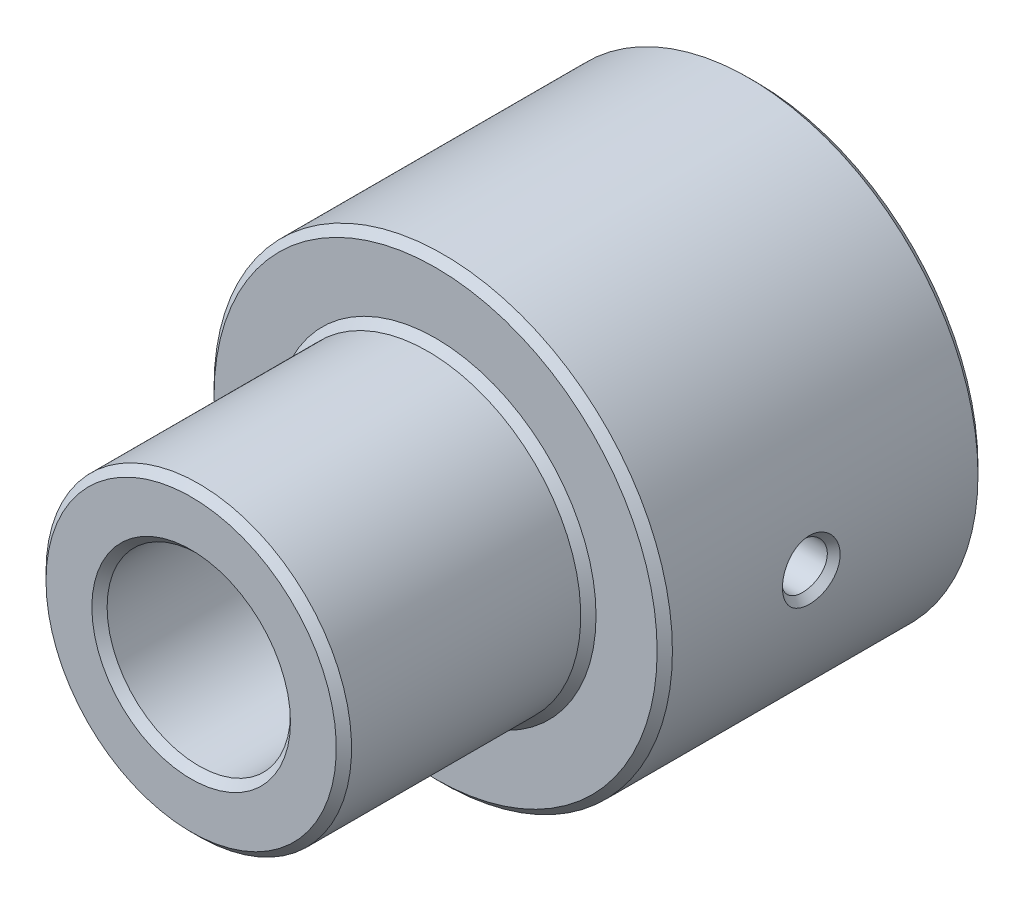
SolidWorks part; units mm, degrees
ref_plane "Спереди" through (0, 0, 0) normal (0, 0, 1) x (1, 0, 0)
ref_plane "Сверху" through (0, 0, 0) normal (0, 1, 0) x (1, 0, 0)
ref_plane "Справа" through (0, 0, 0) normal (1, 0, 0) x (0, 0, -1)
sketch "Эскиз1" plane through (0, 0, 0) normal (1, 0, 0) x (0, 0, -1)
  line L0 (0, 0) -> (37, 0) construction
  line L1 (0, 6) -> (37, 6)
  line L2 (37, 6) -> (37, 15)
  line L3 (37, 15) -> (16, 15)
  line L4 (16, 15) -> (16, 10)
  line L5 (16, 10) -> (0, 10)
  line L6 (0, 10) -> (0, 6)
  dimension "D1" = 37
  dimension "D2" = 12
  dimension "D3" = 20
  dimension "D4" = 30
  dimension "D5" = 21
revolve "Повернуть1" add sketch "Эскиз1" angle 360 about L0
sketch "Эскиз2" plane through (0, 0, 0) normal (1, 0, 0) x (0, 0, -1)
  line L0 (37, -15) -> (37, 15) construction
  circle A0 centre (25.59, 0) radius 1.5
  dimension "D1" = 3
  dimension "D2" = 11.41
extrude "Вырез-Вытянуть1" cut sketch "Эскиз2" against normal mid plane 30
chamfer "Фаска1" distance 0.5 angle 45 10 edges at (6, 0, -37) (15, 0, -37) (5.9928, -0.2934, -24.119) (-5.9928, 0.2934, -24.119) (-14.9962, -0.3366, -24.1282) (14.9962, 0.3366, -24.1282) (15, 0, -16) (10, 0, -16) (10, 0, 0) (6, 0, 0)
